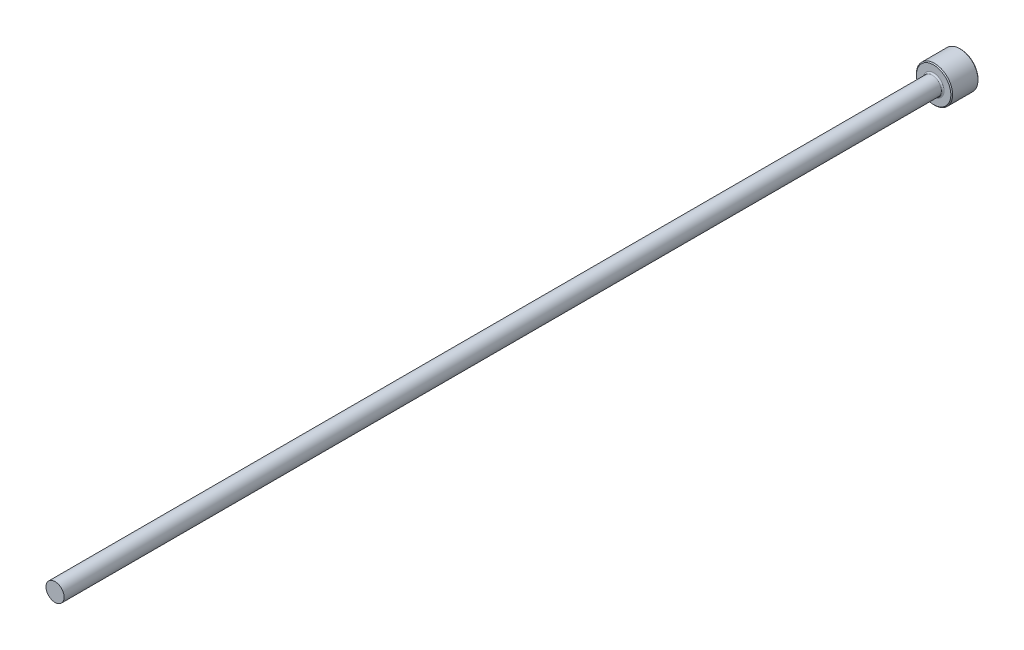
SolidWorks part; units mm, degrees
ref_plane "Front Plane" through (0, 0, 0) normal (0, 0, 1) x (1, 0, 0)
ref_plane "Top Plane" through (0, 0, 0) normal (0, 1, 0) x (1, 0, 0)
ref_plane "Right Plane" through (0, 0, 0) normal (1, 0, 0) x (0, 0, -1)
sketch "Sketch1" plane through (0, 0, 0) normal (1, 0, 0) x (0, 0, -1)
  line L0 (0, 0) -> (0, 4)
  line L1 (0, 3.85) -> (0, -3.85) construction
  line L2 (0, 4) -> (-6, 4)
  line L3 (-6, 4) -> (-6, 2.3)
  line L4 (-6.3, 2) -> (-200, 2)
  line L5 (-200, 2) -> (-200, 0)
  line L6 (3.85, 0) -> (-3.85, 0) construction
  line L7 (-200, 0) -> (0, 0)
  line L8 (-109.0506, 0) -> (16.9928, 0) construction
  arc A0 (-6, 2.3) -> (-6.3, 2) centre (-6.3, 2.3) cw
  dimension "D1" = 0.3
  dimension "D2" = 8
  dimension "D3" = 4
  dimension "D4" = 200
  dimension "D5" = 6
revolve "Revolve1" add sketch "Sketch1" angle 360 about L8
chamfer "Chamfer1" distance 0.2 angle 45 2 edges at (4, 0, 0) (4, 0, 6)
